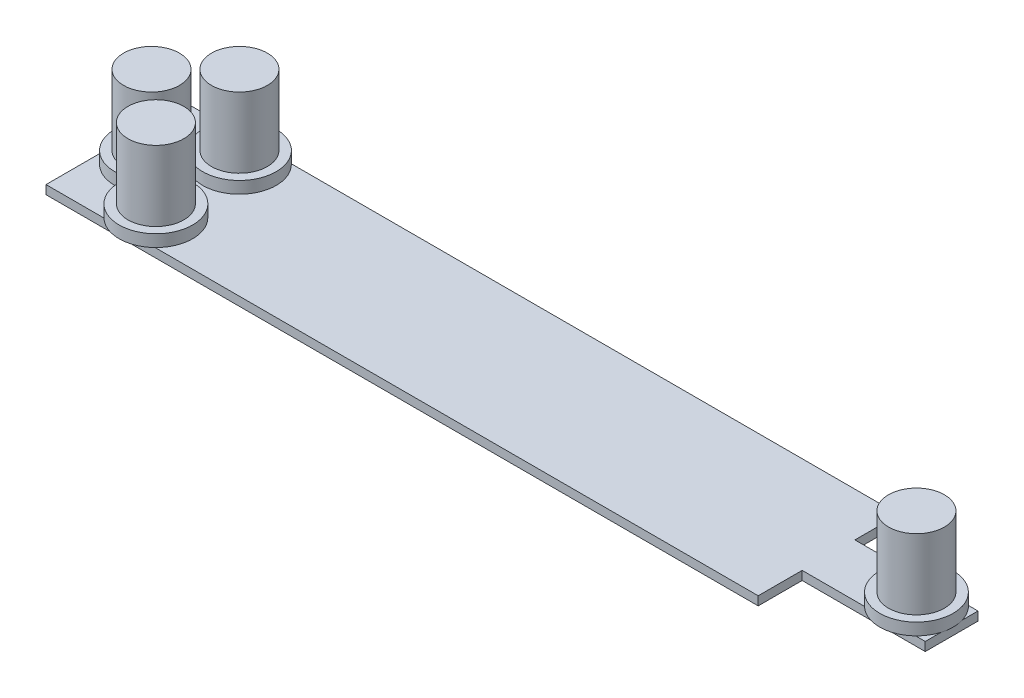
SolidWorks part; units mm, degrees
ref_plane "Front Plane" through (0, 0, 0) normal (0, 0, 1) x (1, 0, 0)
ref_plane "Top Plane" through (0, 0, 0) normal (0, 1, 0) x (1, 0, 0)
ref_plane "Right Plane" through (0, 0, 0) normal (1, 0, 0) x (0, 0, -1)
sketch "Sketch1" plane through (0, 0, 0) normal (0, 1, 0) x (1, 0, 0)
  line L0 (47.5, 3) -> (33.5, 3)
  line L1 (33.5, -8) -> (-47.5, -8)
  line L2 (47.5, -3) -> (47.5, 3)
  line L3 (33.5, 8) -> (-47.5, 8)
  line L4 (-47.5, -8) -> (-47.5, 8)
  line L5 (47.5, -8) -> (-47.5, 8) construction
  line L6 (47.5, 8) -> (-47.5, -8) construction
  line L7 (33.5, 3) -> (33.5, 8)
  line L8 (47.5, -3) -> (33.5, -3)
  line L9 (33.5, -3) -> (33.5, -8)
  point P0 (0, 0)
  dimension "D1" = 95
  dimension "D2" = 16
  dimension "D3" = 5
  dimension "D4" = 5
  dimension "D5" = 14
  dimension "D6" = 14
extrude "Boss-Extrude1" add sketch "Sketch1" along normal blind 1
sketch "Sketch2" plane through (0, 1, 0) normal (0, 1, 0) x (1, 0, 0)
  line L0 (-42.5, 0) -> (42.5, 0)
  line L1 (-38.5, 4) -> (-38.5, 0)
  line L2 (-38.5, 0) -> (-38, 0)
  line L3 (-38, 0) -> (-38, -4)
  line L4 (-38, 0) -> (-38.5, 0)
  circle A0 centre (-38.5, 5) radius 1
  circle A1 centre (-43.5, 0) radius 1
  circle A2 centre (-38, -5) radius 1
  circle A3 centre (43.5, 0) radius 1
  dimension "D1" = 2
  dimension "D2" = 2
  dimension "D3" = 2
  dimension "D4" = 2
  dimension "D5" = 4
  dimension "D6" = 4
  dimension "D7" = 0.5
  dimension "D8" = 85
  dimension "D9" = 4
sketch "Sketch4" plane through (0, 1, 0) normal (0, 1, 0) x (1, 0, 0)
  line L0 (-42.5195, -4.0634) -> (-40.3182, -0.7015)
  line L1 (-40.3182, -0.7015) -> (-40.3182, 0.4435)
  line L2 (-40.3182, 0.4435) -> (-43.2804, 4.1742)
  arc A0 (-43.2804, 4.1742) -> (-42.5195, -4.0634) centre (-43.5, 0) ccw
  circle A1 centre (-38.5, 5) radius 4.18
  circle A2 centre (-38, -5) radius 4.18
  circle A3 centre (43.5, 0) radius 4.18
extrude "Boss-Extrude2" add sketch "Sketch4" along normal blind 1.36
sketch "Sketch5" plane through (0, 2.36, 0) normal (0, 1, 0) x (1, 0, 0)
  circle A0 centre (-38.5, 5) radius 3.18
  circle A1 centre (-43.5, 0) radius 3.18
  circle A2 centre (-38, -5) radius 3.18
  circle A3 centre (43.5, 0) radius 3.18
extrude "Boss-Extrude3" add sketch "Sketch5" along normal blind 8
